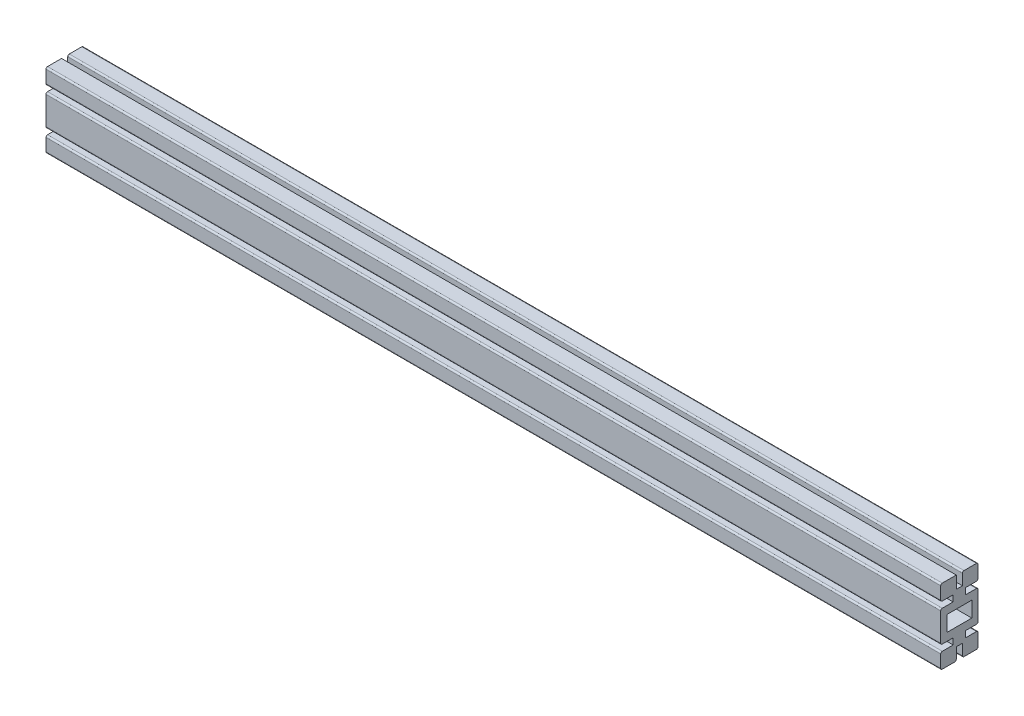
SolidWorks part; units mm, degrees
ref_plane "Front Plane" through (0, 0, 0) normal (0, 0, 1) x (1, 0, 0)
ref_plane "Top Plane" through (0, 0, 0) normal (0, 1, 0) x (1, 0, 0)
ref_plane "Right Plane" through (0, 0, 0) normal (1, 0, 0) x (0, 0, -1)
sketch "Sketch1" plane through (0, 0, 0) normal (1, 0, 0) x (0, 0, -1)
  line L1 (-19.05, -38.1) -> (19.05, -38.1)
  line L2 (-19.05, -38.1) -> (-19.05, 38.1)
  line L3 (-19.05, 38.1) -> (19.05, 38.1)
  line L4 (19.05, -38.1) -> (19.05, 38.1)
  dimension "D1" = 38.1
  dimension "D2" = 19.05
  dimension "D3" = 76.2
  dimension "D4" = 38.1
extrude "Boss-Extrude1" add sketch "Sketch1" against normal blind 914.4
sketch "Sketch2" plane through (0, 0, 0) normal (1, 0, 0) x (0, 0, -1)
  line L0 (-19.05, 38.1) -> (-19.05, -38.1) construction
  line L1 (-19.05, 15.875) -> (-6.35, 15.875)
  line L2 (-19.05, 15.875) -> (-19.05, 22.225)
  line L3 (-19.05, 22.225) -> (-6.35, 22.225)
  line L4 (-6.35, 15.875) -> (-6.35, 22.225)
  line L5 (19.05, -38.1) -> (19.05, 38.1) construction
  line L6 (-19.05, -22.225) -> (-6.35, -22.225)
  line L7 (-19.05, -22.225) -> (-19.05, -15.875)
  line L8 (-19.05, -15.875) -> (-6.35, -15.875)
  line L9 (-6.35, -22.225) -> (-6.35, -15.875)
  line L10 (19.05, -22.225) -> (6.35, -22.225)
  line L11 (19.05, -22.225) -> (19.05, -15.875)
  line L12 (19.05, -15.875) -> (6.35, -15.875)
  line L13 (6.35, -22.225) -> (6.35, -15.875)
  line L14 (19.05, 38.1) -> (-19.05, 38.1) construction
  line L15 (19.05, 15.875) -> (6.35, 15.875)
  line L16 (19.05, 15.875) -> (19.05, 22.225)
  line L17 (19.05, 22.225) -> (6.35, 22.225)
  line L18 (6.35, 15.875) -> (6.35, 22.225)
  line L19 (-3.175, 38.1) -> (3.175, 38.1)
  line L20 (-3.175, 38.1) -> (-3.175, 25.4)
  line L21 (-3.175, 25.4) -> (3.175, 25.4)
  line L22 (3.175, 38.1) -> (3.175, 25.4)
  line L23 (-19.05, -38.1) -> (19.05, -38.1) construction
  line L24 (-3.175, -38.1) -> (3.175, -38.1)
  line L25 (-3.175, -38.1) -> (-3.175, -25.4)
  line L26 (-3.175, -25.4) -> (3.175, -25.4)
  line L27 (3.175, -38.1) -> (3.175, -25.4)
  dimension "D1" = 6.35
  dimension "D2" = 6.35
  dimension "D3" = 6.35
  dimension "D4" = 6.35
  dimension "D5" = 15.875
  dimension "D6" = 15.875
  dimension "D7" = 15.875
  dimension "D8" = 15.875
  dimension "D9" = 12.7
  dimension "D10" = 12.7
  dimension "D11" = 12.7
  dimension "D12" = 12.7
  dimension "D13" = 6.35
  dimension "D14" = 12.7
  dimension "D15" = 15.875
  dimension "D16" = 6.35
  dimension "D17" = 12.7
  dimension "D18" = 15.875
extrude "Cut-Extrude1" cut sketch "Sketch2" against normal through all
sketch "Sketch3" plane through (0, 0, 0) normal (1, 0, 0) x (0, 0, -1)
  line L1 (-12.7, -7.9248) -> (12.7, -7.9248)
  line L2 (-12.7, -7.9248) -> (-12.7, 7.9502)
  line L3 (-12.7, 7.9502) -> (12.7, 7.9502)
  line L4 (12.7, -7.9248) -> (12.7, 7.9502)
  dimension "D1" = 12.7
  dimension "D2" = 25.4
  dimension "D3" = 15.875
  dimension "D4" = 7.9248
extrude "Cut-Extrude2" cut sketch "Sketch3" against normal through all
fillet "Fillet1" radius 1.5748 15 edges at (-457.2, 22.225, -19.05) (-457.2, -15.875, -19.05) (-457.2, -38.1, 3.175) (-457.2, -38.1, -3.175) (-457.2, -38.1, -19.05) (-457.2, 38.1, -19.05) (-457.2, -38.1, 19.05) (-457.2, -22.225, -19.05) (-457.2, 15.875, -19.05) (-457.2, 38.1, -3.175) (-457.2, 38.1, 19.05) (-457.2, -22.225, 19.05) (-457.2, -15.875, 19.05) (-457.2, 15.875, 19.05) (-457.2, 22.225, 19.05)
